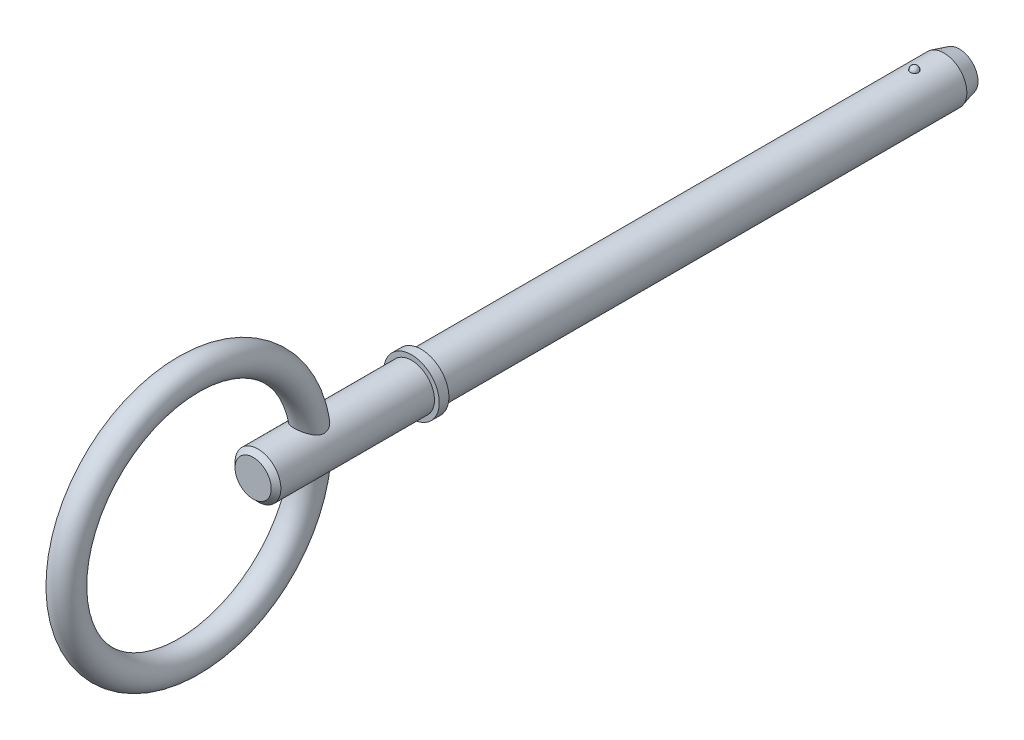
SolidWorks part; units mm, degrees
ref_plane "Front Plane" through (0, 0, 0) normal (0, 0, 1) x (1, 0, 0)
ref_plane "Top Plane" through (0, 0, 0) normal (0, 1, 0) x (1, 0, 0)
ref_plane "Right Plane" through (0, 0, 0) normal (1, 0, 0) x (0, 0, -1)
sketch "Sketch2" plane through (0, 0, 0) normal (0, 0, 1) x (1, 0, 0)
  circle A0 centre (0, 0) radius 2.38
  point P3 (0, 2.38)
  dimension "D1" = 4.76
extrude "Boss-Extrude1" add sketch "Sketch2" along normal blind 50.8
sketch "Sketch3" plane through (0, 0, 0) normal (0, 0, -1) x (-1, 0, 0)
  circle A0 centre (0, 0) radius 2.38
  dimension "D1" = 4.76
extrude "Boss-Extrude2" add sketch "Sketch3" along normal blind 5.08
chamfer "Chamfer1" distance 1.586 angle 15 1 edges at (-2.38, 0, -5.08)
sketch "Sketch18" plane through (0, 0, 0) normal (1, 0, 0) x (0, 0, -1)
  line L0 (3.494, 2.38) -> (-50.8, 2.38) construction
  line L1 (0.42, 2.8) -> (0.42, 1.96)
  line L2 (-50.8, -2.38) -> (3.494, -2.38) construction
  arc A0 (0.42, 2.8) -> (0.42, 1.96) centre (0.42, 2.38) ccw
  point P4 (0, 2.38)
  dimension "D1" = 5.18
revolve "Revolve1" add sketch "Sketch18" angle 360 about L1
sketch "Sketch19" plane through (0, 0, 0) normal (1, 0, 0) x (0, 0, -1)
  line L0 (-33.7288, 0) -> (-46.4542, 0) construction
sketch "Sketch20" plane through (0, 0, 0) normal (1, 0, 0) x (0, 0, -1)
  line L0 (-50.8, 0) -> (-50.8, 2.88)
  line L1 (-50.8, 2.38) -> (-50.8, -2.38) construction
  line L2 (-50.8, 2.88) -> (-51.8, 2.88)
  line L3 (-51.8, 2.88) -> (-51.8, 0)
  line L4 (-33.7288, 0) -> (-46.4542, 0) construction
  line L5 (-51.8, 0) -> (-50.8, 0)
  dimension "D1" = 2.88
  dimension "D2" = 1
revolve "Revolve2" add sketch "Sketch20" angle 360 about L0
sketch "Sketch21" plane through (0, 0, 50.8) normal (0, 0, -1) x (-1, 0, 0)
  circle A0 centre (0, 0) radius 2.38
  dimension "D1" = 4.76
extrude "Boss-Extrude3" add sketch "Sketch21" against normal blind 17.45
chamfer "Chamfer2" distance 0.5 angle 45 1 edges at (-2.38, 0, 68.25)
sketch "Sketch23" plane through (0, 0, 0) normal (1, 0, 0) x (0, 0, -1)
  line L0 (-68.25, 1.88) -> (-68.25, -1.88) construction
  circle A0 centre (-74.95, 0) radius 12.7
  point P2 (-62.25, 0)
  dimension "D1" = 25.4
  dimension "D2" = 6
sketch "Sketch24" plane through (0, 0, 0) normal (0, 1, 0) x (1, 0, 0)
  circle A0 centre (0, -62.25) radius 1.5
  dimension "D1" = 3
sweep "Sweep1" add profiles "Sketch24" path "Sketch23"
